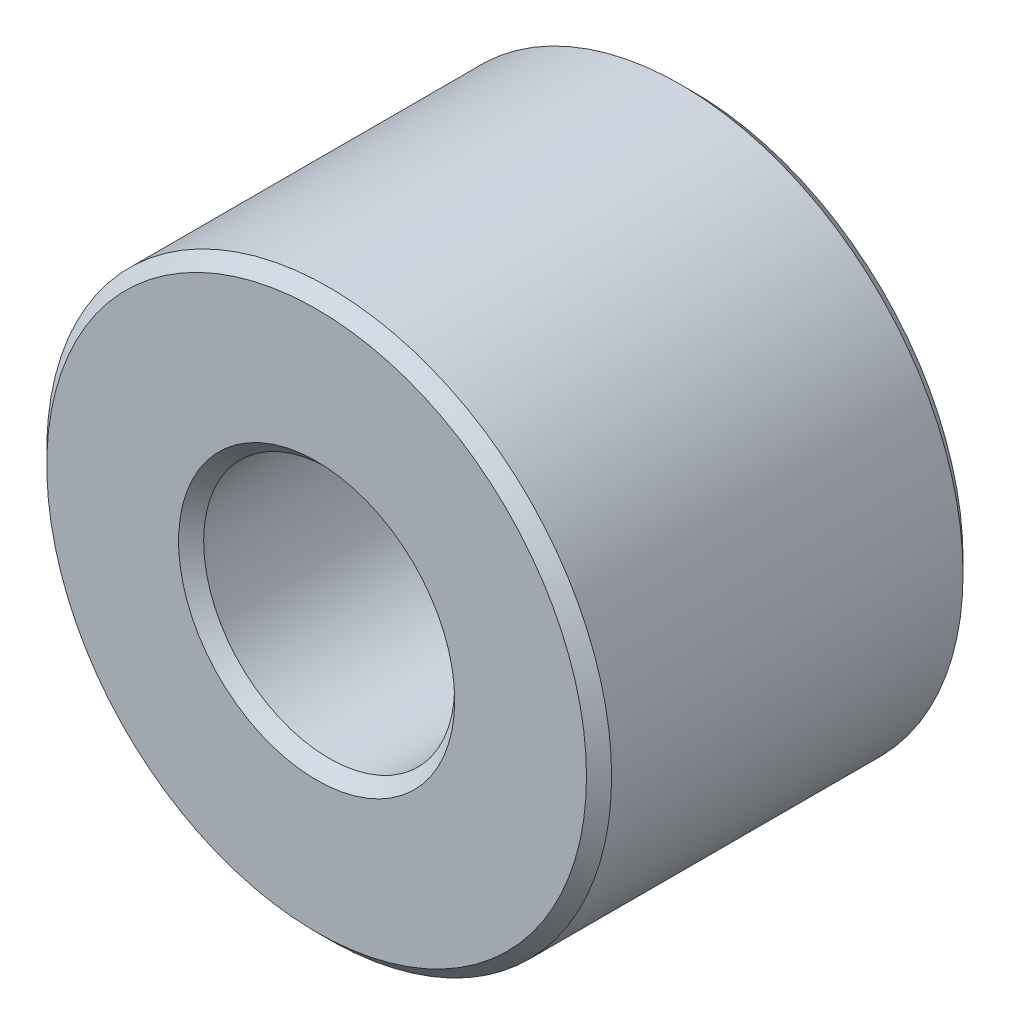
SolidWorks part; units mm, degrees
ref_plane "Front Plane" through (0, 0, 0) normal (0, 0, 1) x (1, 0, 0)
ref_plane "Top Plane" through (0, 0, 0) normal (0, 1, 0) x (1, 0, 0)
ref_plane "Right Plane" through (0, 0, 0) normal (1, 0, 0) x (0, 0, -1)
sketch "Sketch1" plane through (0, 0, 0) normal (0, 0, 1) x (1, 0, 0)
  circle A0 centre (0, 0) radius 4
  circle A1 centre (0, 0) radius 9
  dimension "D1" = 8
  dimension "D2" = 18
extrude "Boss-Extrude1" add sketch "Sketch1" along normal mid plane 12
chamfer "Chamfer1" distance 0.4 angle 45 4 edges at (4, 0, -6) (9, 0, -6) (4, 0, 6) (9, 0, 6)
